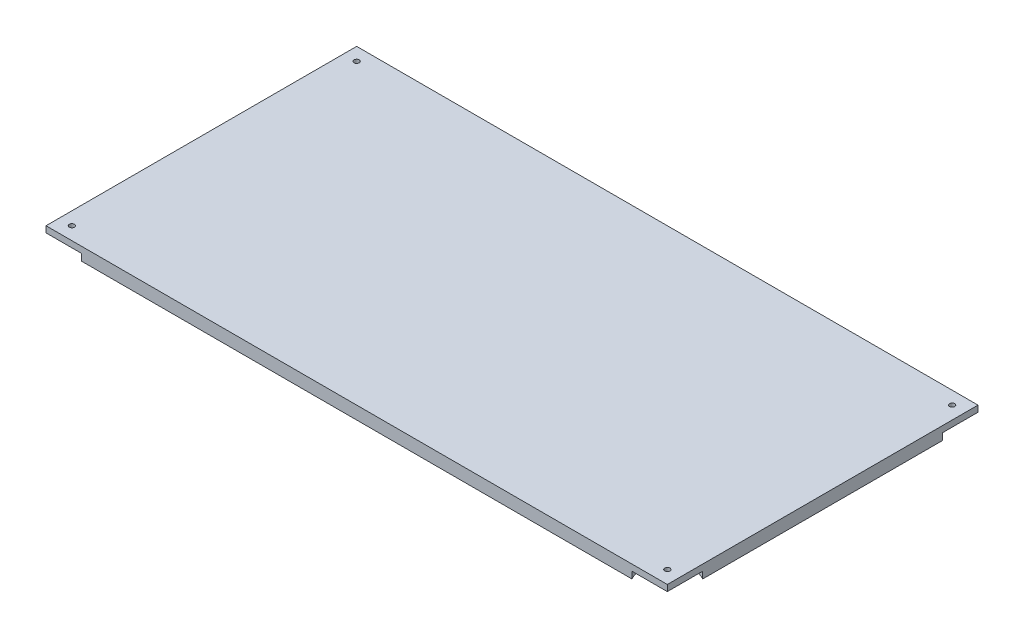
SolidWorks part; units mm, degrees
ref_plane "Front Plane" through (0, 0, 0) normal (0, 0, 1) x (1, 0, 0)
ref_plane "Top Plane" through (0, 0, 0) normal (0, 1, 0) x (1, 0, 0)
ref_plane "Right Plane" through (0, 0, 0) normal (1, 0, 0) x (0, 0, -1)
sketch "Sketch1" plane through (0, 0, 0) normal (0, 1, 0) x (1, 0, 0)
  line L1 (-48.4647, 36.7883) -> (256.3353, 36.7883)
  line L2 (-48.4647, 36.7883) -> (-48.4647, -115.6117)
  line L3 (-48.4647, -115.6117) -> (256.3353, -115.6117)
  line L4 (256.3353, 36.7883) -> (256.3353, -115.6117)
  dimension "D1" = 304.8
  dimension "D2" = 152.4
extrude "Boss-Extrude1" add sketch "Sketch1" along normal blind 6.35
hole_wizard "#97 (0.0059) Diameter Hole1" positions "Sketch3" profile "Sketch4" hole size "#97" standard "Ansi Inch"
sketch "Sketch3" plane through (0, 0, 0) normal (0, -1, 0) x (1, 0, 0)
  line L0 (-48.4647, 115.6117) -> (256.3353, 115.6117) construction
  line L1 (256.3353, 115.6117) -> (256.3353, -36.7883) construction
  point P0 (249.9853, 109.2617)
  dimension "D1" = 6.35
  dimension "D2" = 6.35
sketch "Sketch4" plane through (249.9853, 0, 109.2617) normal (1, 0, 0) x (0, 0, -1)
  line L0 (0, 0) -> (0, 6.351)
  line L1 (0, 6.351) -> (1.27, 6.351)
  line L2 (1.27, 6.351) -> (1.27, 0)
  line L5 (1.27, 0) -> (0, 0)
  line L11 (0, -6.35) -> (0, 107.95) construction
  dimension "Thru Hole Dia." = 2.54
  dimension "Thru Hole Depth" = 6.351
ref_plane "Plane1" through (103.9353, 0, 0) normal (-1, 0, 0) x (0, 0, 1)
ref_plane "Plane2" through (0, 0, 39.4117) normal (0, 0, 1) x (1, 0, 0)
hole_wizard "#97 (0.0059) Diameter Hole2" positions "Sketch6" profile "Sketch5" hole size "#97" standard "Ansi Inch"
sketch "Sketch6" plane through (0, 0, 0) normal (0, -1, 0) x (1, 0, 0)
  line L0 (256.3353, 115.6117) -> (256.3353, -36.7883) construction
  line L1 (-48.4647, 115.6117) -> (256.3353, 115.6117) construction
  point P0 (249.9853, 109.2617)
  dimension "D1" = 6.35
  dimension "D2" = 6.35
sketch "Sketch5" plane through (249.9853, 0, 109.2617) normal (1, 0, 0) x (0, 0, -1)
  line L0 (0, 0) -> (0, 3.302)
  line L1 (0, 3.302) -> (12.7, 3.302)
  line L2 (12.7, 3.302) -> (12.7, 0)
  line L5 (12.7, 0) -> (0, 0)
  line L10 (0, 3.302) -> (-12.7, 3.302) construction
  line L11 (0, -6.35) -> (0, 107.95) construction
  dimension "Hole Dia." = 25.4
  dimension "Hole Depth" = 3.302
  dimension "Drill Angle" = 180
mirror "Mirror3" about plane through (103.9353, 0, 0) normal (-1, 0, 0) of "#97 (0.0059) Diameter Hole2", "#97 (0.0059) Diameter Hole1"
mirror "Mirror4" about plane through (0, 0, 39.4117) normal (0, 0, 1) of "Mirror3", "#97 (0.0059) Diameter Hole1", "#97 (0.0059) Diameter Hole2"
